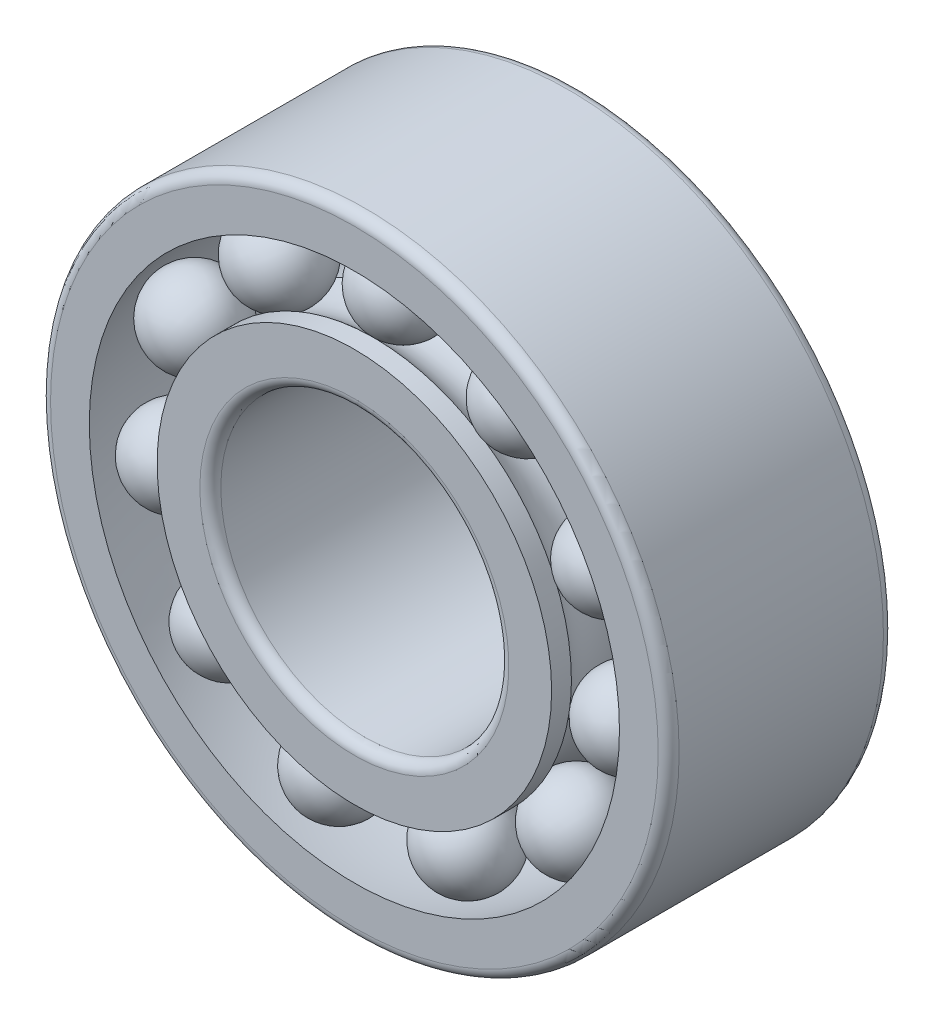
SolidWorks part; units mm, degrees
ref_plane "Front Plane" through (0, 0, 0) normal (0, 0, 1) x (1, 0, 0)
ref_plane "Top Plane" through (0, 0, 0) normal (0, 1, 0) x (1, 0, 0)
ref_plane "Right Plane" through (0, 0, 0) normal (1, 0, 0) x (0, 0, -1)
sketch "BaseSke" plane through (0, 0, 0) normal (1, 0, 0) x (0, 0, -1)
  line L0 (-47.2296, 0) -> (24.6132, 0) construction
  line L1 (-47.2296, 43.75) -> (24.6132, 43.75) construction
  line L2 (0, 129.5214) -> (0, -86.3012) construction
  line L3 (-12.1558, 52.0192) -> (-12.1558, 35.4808)
  line L4 (-21.5, 60) -> (21.5, 60) construction
  line L5 (-21.5, 27.5) -> (21.5, 27.5) construction
  line L6 (-21.5, 60) -> (-21.5, 27.5) construction
  line L7 (21.5, 60) -> (21.5, 27.5) construction
  line L8 (-20.425, 60) -> (-20.425, 27.5) construction
  arc A0 (-12.1558, 52.0192) -> (-12.1558, 35.4808) centre (-12.1558, 43.75) ccw
  dimension "D2" = 1.075
  dimension "Ball_diameter" = 16.5385
  dimension "D1" = 43.75
  dimension "Bearing_Thickness" = 43
  dimension "Bearing_Outside_Diameter" = 120
  dimension "Bearing_Inside_Diameter" = 55
revolve "Ball" add sketch "BaseSke" angle 360 about L3
sketch "OuterRaceSke" plane through (0, 0, 0) normal (1, 0, 0) x (0, 0, -1)
  line L0 (0, 0) -> (0, 87.5396) construction
  line L1 (-21.5, 60) -> (21.5, 60)
  line L2 (-21.5, 60) -> (-21.5, 50.6063)
  line L4 (21.5, 60) -> (21.5, 50.6063)
  line L5 (-50.3916, 0) -> (55.2197, 0) construction
  arc A0 (-21.5, 50.6063) -> (21.5, 50.6063) centre (0, -57.2721) cw
  arc A1 (-21.5, 50.6267) -> (21.5, 50.6267) centre (0, -57.2721) cw construction
  arc A2 (-12.1558, 52.0192) -> (-12.1558, 35.4808) centre (-12.1558, 43.75) ccw construction
  dimension "D1" = 110
  dimension "D2" = 0.02
revolve "OuterRace" add sketch "OuterRaceSke" angle 360 about L5
mirror "MirrorBall" about plane through (0, 0, 0) normal (0, 0, 1) of "Ball"
sketch "InnerRaceSke" plane through (0, 0, 0) normal (1, 0, 0) x (0, 0, -1)
  line L0 (-70.8626, 0) -> (113.5527, 0) construction
  line L1 (0, 58.441) -> (0, -70.8113) construction
  line L2 (-21.5, 27.5) -> (21.5, 27.5)
  line L3 (-21.5, 27.5) -> (-21.5, 37.6562)
  line L4 (-21.5, 37.6562) -> (-17.7308, 37.6562)
  line L5 (21.5, 27.5) -> (21.5, 37.6563)
  line L6 (0, 129.5214) -> (0, -86.3012) construction
  line L7 (-6.5807, 37.6562) -> (6.5807, 37.6562)
  line L8 (21.5, 37.6563) -> (17.7308, 37.6562)
  arc A0 (-17.7308, 37.6562) -> (-6.5807, 37.6562) centre (-12.1558, 43.75) ccw
  circle A1 centre (-12.1558, 43.75) radius 8.2692 construction
  arc A2 (17.7308, 37.6562) -> (6.5807, 37.6562) centre (12.1558, 43.75) cw
  point P17 (0, 27.5)
  point P23 (0, 37.6562)
  dimension "D2" = 16.5185
  dimension "D1" = 75.3125
revolve "InnerRace" add sketch "InnerRaceSke" angle 360 about L0
fillet "Fillet1" radius 2 4 edges at (27.5, 0, -21.5) (27.5, 0, 21.5) (60, 0, -21.5) (60, 0, 21.5)
pattern_circular "CirPatternBall" count 11 over 360 about axis through (0, 0, 0) along (0, 0, 1) of "Ball", "MirrorBall"
sketch "TaperSke" plane through (0, 0, 0) normal (1, 0, 0) x (0, 0, -1)
  line L0 (-21.5, 27.5) -> (21.5, 27.5)
  line L1 (21.5, 27.5) -> (21.5, 31.0833)
  line L2 (21.5, 31.0833) -> (-21.5, 27.5)
  line L7 (-41.2502, 0) -> (40.8606, 0) construction
  dimension "Taper" = 3.5833
revolve "Taper" [suppressed] cut sketch "TaperSke" angle 360 about L7
fillet "Fillet2" [suppressed] radius 2
sketch "SimplifiedSke" plane through (0, 0, 0) normal (1, 0, 0) x (0, 0, -1)
  line L0 (37.5911, 0) -> (-37.5911, 0) construction
  line L1 (0, 0) -> (0, 72.9012) construction
  circle A0 centre (-12.1558, 43.75) radius 8.2692
  circle A1 centre (-12.1558, 43.75) radius 8.2692 construction
  circle A2 centre (12.1558, 43.75) radius 8.2692
revolve "Simplified" [suppressed] add sketch "SimplifiedSke" angle 360 about L0
equation "\"D1@BaseSke\" =  (\"Bearing_Outside_Diameter@BaseSke\"  +  \"Bearing_Inside_Diameter@BaseSke\"  )  / 4"
equation "\"Ball_diameter@BaseSke\" = \"Bearing_Thickness@BaseSke\" / 2.6"
equation "\"D2@BaseSke\" = \"Bearing_Thickness@BaseSke\"/40"
equation "\"D1@OuterRaceSke\" = \"Bearing_Inside_Diameter@BaseSke\"*2"
equation "\"D1@InnerRaceSke\" = \"Bearing_Inside_Diameter@BaseSke\" +  ( \"Bearing_Outside_Diameter@BaseSke\" - \"Bearing_Inside_Diameter@BaseSke\" )  / 3.2"
equation "\"D2@InnerRaceSke\" = \"Ball_diameter@BaseSke\"-0.02"
equation "\"D1@CirPatternBall\" = int( \"D1@BaseSke\"* pi  * 2 / \"Ball_diameter@BaseSke\" /1.4)"
equation "\"Taper@TaperSke\" = \"Bearing_Thickness@BaseSke\"/12"
equation "\"D1@Fillet2\" = \"Fillet_radius@Fillet1\""
